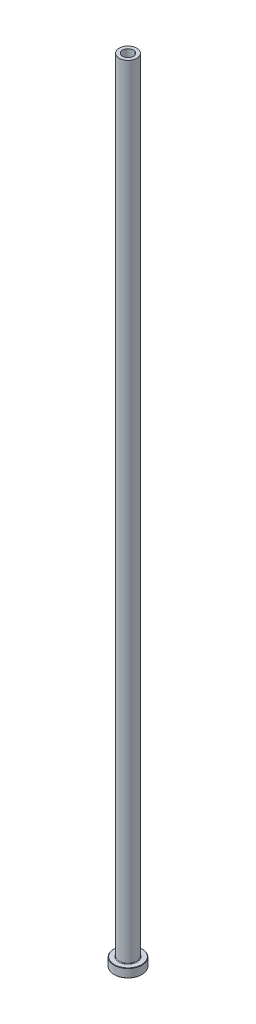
SolidWorks part; units mm, degrees
ref_plane "Front Plane" through (0, 0, 0) normal (0, 0, 1) x (1, 0, 0)
ref_plane "Top Plane" through (0, 0, 0) normal (0, 1, 0) x (1, 0, 0)
ref_plane "Right Plane" through (0, 0, 0) normal (1, 0, 0) x (0, 0, -1)
sketch "Sketch1" plane through (0, 0, 0) normal (0, 0, 1) x (1, 0, 0)
  line L0 (-3.1, 450) -> (-5, 450)
  line L1 (-5, 450) -> (-5, 5)
  line L2 (-5, 5) -> (-8, 5)
  line L3 (-8, 5) -> (-8, 0)
  line L4 (8.8, 0) -> (-8.8, 0) construction
  line L5 (-8, 0) -> (-3.35, 0)
  line L6 (-3.1, 405) -> (-3.1, 450)
  line L7 (0, 92.1877) -> (0, -15.5353) construction
  line L8 (0, -8.8) -> (0, 8.8) construction
  line L9 (-3.1, 405) -> (-3.35, 393)
  line L10 (-3.35, 393) -> (-3.35, 0)
  dimension "D1" = 0.25
  dimension "ID" = 6.2
  dimension "OD" = 10
  dimension "L" = 450
  dimension "H" = 16
  dimension "T" = 5
  dimension "N" = 45
  dimension "D2" = 12
revolve "Revolve1" add sketch "Sketch1" angle 360 about L7
fillet "Fillet1" radius 0.3 1 edges at (0, 5, 5)
chamfer "Chamfer1" distance 0.2 angle 45 2 edges at (0, 5, 8) (0, 0, 8)
chamfer "Chamfer3" distance 0.5 angle 45 1 edges at (0, 0, 3.35)
